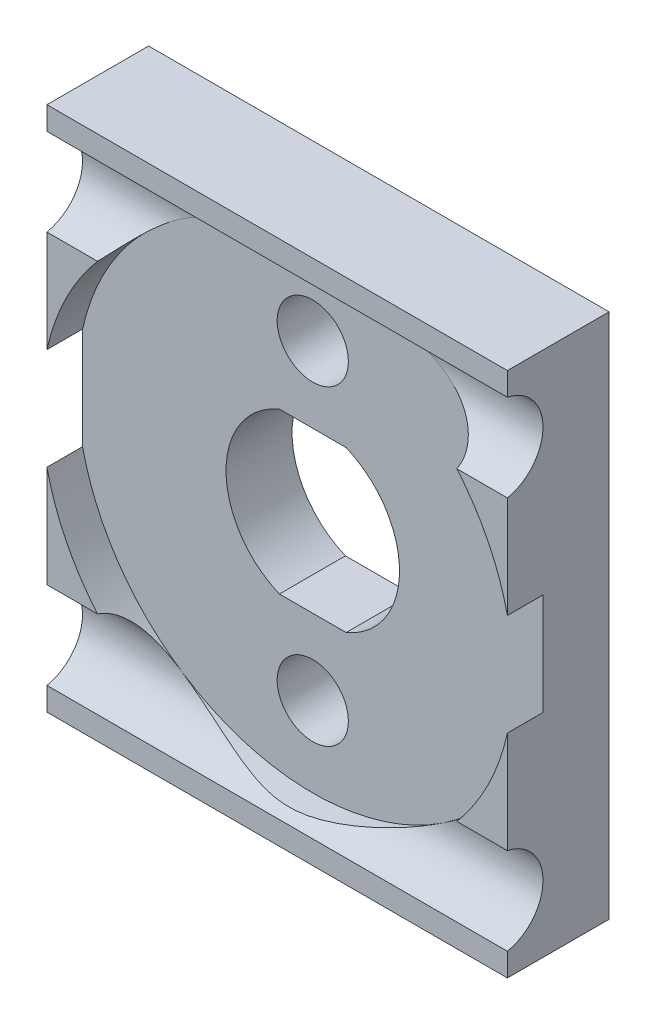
SolidWorks part; units mm, degrees
ref_plane "Plan de face" through (0, 0, 0) normal (0, 0, 1) x (1, 0, 0)
ref_plane "Plan de dessus" through (0, 0, 0) normal (0, 1, 0) x (1, 0, 0)
ref_plane "Plan de droite" through (0, 0, 0) normal (1, 0, 0) x (0, 0, -1)
sketch "Esquisse1" plane through (0, 0, 0) normal (0, 0, 1) x (1, 0, 0)
  line L1 (-20.7, 23.65) -> (0, 23.65)
  line L2 (-20.7, 23.65) -> (-20.7, 0)
  line L3 (-20.7, 0) -> (0, 0)
  line L4 (0, 23.65) -> (0, 0)
  dimension "D1" = 20.7
  dimension "D2" = 23.65
extrude "Extrusion1" add sketch "Esquisse1" along normal blind 4.57
sketch "Esquisse2" plane through (0, 0, 4.57) normal (0, 0, 1) x (1, 0, 0)
  line L0 (-10.35, 23.65) -> (-10.35, -5.2926) construction
  line L1 (0, 23.65) -> (-20.7, 23.65) construction
  line L2 (-20.7, 11.825) -> (0, 11.825) construction
  line L3 (-20.7, 23.65) -> (-20.7, 0) construction
  line L4 (0, 0) -> (0, 23.65) construction
  line L5 (-11.85, 8.225) -> (-8.85, 8.225)
  line L6 (-14.44, 11.825) -> (-6.26, 11.825)
  line L7 (-11.85, 8.225) -> (-11.85, 15.425)
  line L8 (-11.85, 15.425) -> (-8.85, 15.425)
  line L9 (-8.85, 8.225) -> (-8.85, 15.425)
  circle A0 centre (-10.35, 11.825) radius 3.9
  point P17 (-10.35, 11.825)
  dimension "D1" = 3.6
  dimension "D2" = 1.5
  dimension "D3" = 1.5
  dimension "D4" = 4.09
extrude "Enlèv. mat.-Extru.1" cut sketch "Esquisse2" against normal through all
sketch "Esquisse3" plane through (0, 0, 4.57) normal (0, 0, 1) x (1, 0, 0)
  line L0 (-10.35, 23.65) -> (-10.35, 0) construction
  line L1 (0, 23.65) -> (-20.7, 23.65) construction
  line L2 (-20.7, 0) -> (0, 0) construction
  line L3 (-20.7, 11.825) -> (0, 11.825) construction
  line L4 (-20.7, 23.65) -> (-20.7, 0) construction
  line L5 (0, 0) -> (0, 23.65) construction
  line L6 (-11.85, 15.425) -> (-8.85, 15.425) construction
  circle A0 centre (-10.35, 18.825) radius 1.6
  circle A1 centre (-10.35, 4.825) radius 1.6
  point P16 (-10.35, 15.425)
  point P17 (-10.35, 18.825)
  point P22 (-10.35, 11.825)
  dimension "D2" = 3.2
  dimension "D1" = 7
extrude "Enlèv. mat.-Extru.2" cut sketch "Esquisse3" against normal through all
sketch "Esquisse4" plane through (0, 0, 4.57) normal (0, 0, 1) x (1, 0, 0)
  line L0 (-10.35, 23.65) -> (-10.35, 0) construction
  line L1 (0, 23.65) -> (-20.7, 23.65) construction
  line L2 (-20.7, 0) -> (0, 0) construction
  line L3 (-20.7, 11.825) -> (0, 11.825) construction
  line L4 (-20.7, 23.65) -> (-20.7, 0) construction
  line L5 (0, 0) -> (0, 23.65) construction
  line L6 (-15.775, 23.65) -> (-4.925, 23.65)
  line L7 (-15.775, 20.9316) -> (0, 20.9316) construction
  line L8 (0, 20.9316) -> (-20.7, 20.9316) construction
  line L9 (-15.775, 20.9316) -> (-15.775, 23.65)
  line L10 (-4.925, 23.65) -> (-4.925, 20.9316)
  line L11 (-4.925, 0) -> (-4.925, 2.7184)
  line L12 (-15.775, 0) -> (-4.925, 0)
  line L13 (-15.775, 2.7184) -> (-15.775, 0)
  circle A0 centre (-10.35, 11.825) radius 10.6
  dimension "D1" = 21.2
  dimension "D2" = 5.425
extrude "Enlèv. mat.-Extru.3" cut sketch "Esquisse4" against normal blind 1.6
sketch "Esquisse7" plane through (0, 0, 0) normal (1, 0, 0) x (0, 0, -1)
  line L0 (-2.97, 9.5364) -> (-2.97, 23.65) construction
  line L1 (-4.57, 23.65) -> (0, 23.65) construction
  line L2 (0, 11.825) -> (-2.97, 11.825) construction
  line L3 (0, 0) -> (0, 23.65) construction
  line L4 (-4.97, 20.65) -> (-2.97, 20.65) construction
  circle A0 centre (-4.97, 20.65) radius 2
  circle A1 centre (-4.97, 3) radius 2
  dimension "D2" = 4
  dimension "D1" = 3
extrude "Enlèv. mat.-Extru.6" cut sketch "Esquisse7" against normal through all
